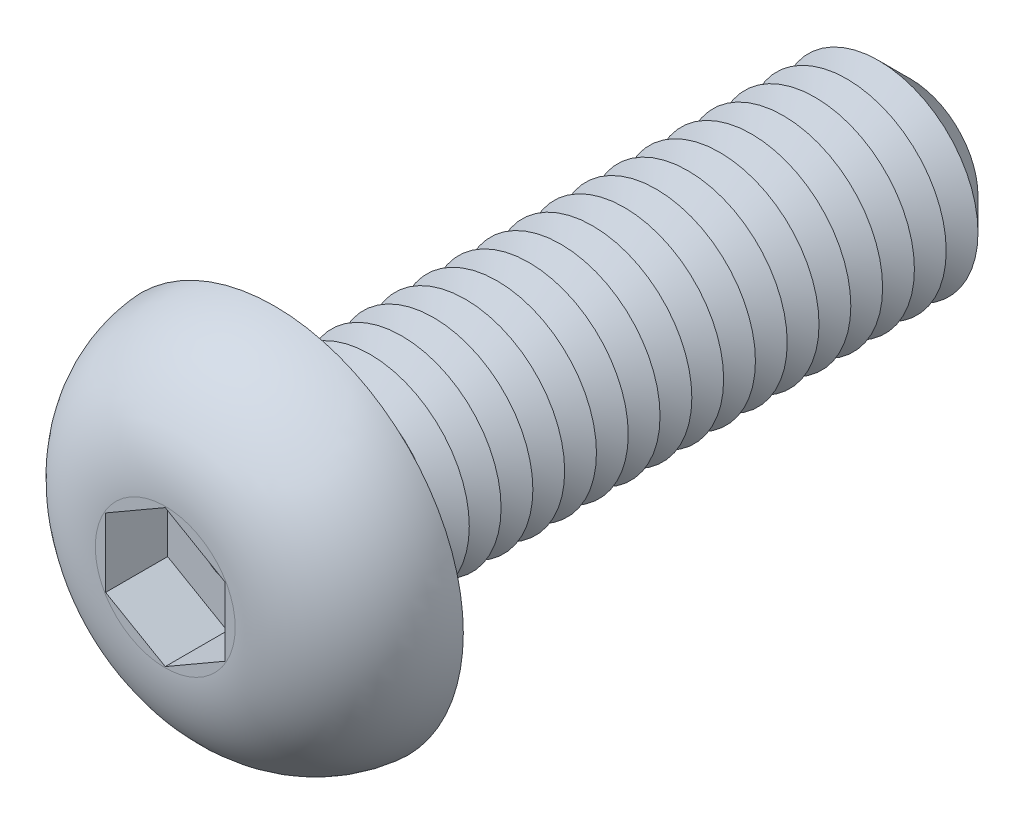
SolidWorks part; units mm, degrees
ref_plane "Front Plane" through (0, 0, 0) normal (0, 0, 1) x (1, 0, 0)
ref_plane "Top Plane" through (0, 0, 0) normal (0, 1, 0) x (1, 0, 0)
ref_plane "Right Plane" through (0, 0, 0) normal (1, 0, 0) x (0, 0, -1)
sketch "Sketch1" plane through (0, 0, 0) normal (1, 0, 0) x (0, 0, -1)
  line L0 (-47.9342, 0) -> (60.3146, 0) construction
sketch "Sketch2" plane through (0, 0, 0) normal (1, 0, 0) x (0, 0, -1)
  line L0 (0, 0) -> (-2.75, 0)
  line L1 (-47.9342, 0) -> (60.3146, 0) construction
  line L2 (-2.75, 0) -> (-2.75, 1.7604)
  line L3 (0, 4.75) -> (0, 0)
  arc A0 (-2.75, 1.7604) -> (0, 4.75) centre (0.25, 1.7604) cw
  dimension "D1" = 3
  dimension "D2" = 2.75
  dimension "D3" = 4.75
revolve "Revolve1" add sketch "Sketch2" angle 360 about L0
sketch "Sketch3" plane through (0, 0, 2.75) normal (0, 0, 1) x (1, 0, 0)
  line L1 (0, 1.7321) -> (-1.5, 0.866)
  line L2 (-1.5, 0.866) -> (-1.5, -0.866)
  line L3 (-1.5, -0.866) -> (0, -1.7321)
  line L4 (0, -1.7321) -> (1.5, -0.866)
  line L5 (1.5, -0.866) -> (1.5, 0.866)
  line L6 (1.5, 0.866) -> (0, 1.7321)
  circle A0 centre (0, 0) radius 1.5 construction
  dimension "D1" = 3
extrude "Cut-Extrude1" cut sketch "Sketch3" against normal blind 1.56
sketch "Sketch4" plane through (0, 0, 0) normal (0, 0, -1) x (-1, 0, 0)
  circle A0 centre (0, 0) radius 2.5
  dimension "D1" = 5
extrude "Boss-Extrude1" add sketch "Sketch4" along normal blind 16
chamfer "Chamfer1" distance 0.8 angle 45 1 edges at (-2.5, 0, -16)
sketch "Sketch5" plane through (0, 0, 0) normal (1, 0, 0) x (0, 0, -1)
  line L0 (0.8, 2.5) -> (1.6, 2.5)
  line L1 (15.2, 2.5) -> (0, 2.5) construction
  line L2 (1.6, 2.5) -> (1.2, 1.8072)
  line L3 (1.2, 1.8072) -> (0.8, 2.5)
  line L4 (0, -4.75) -> (0, 4.75) construction
  line L5 (15.2, 2.5) -> (0, 2.5) construction
  dimension "D1" = 0.8
  dimension "D2" = 0.8
revolve "Cut-Revolve1" cut sketch "Sketch5" angle 360 about L0
pattern_linear "LPattern1" count 18 spacing 0.8 along (0, 0, -1) of "Cut-Revolve1"
fillet "Fillet2" radius 0.4 1 edges at (2.5, 0, 0)
sketch "Sketch6" plane through (0, 0, 1.19) normal (0, 0, 1) x (1, 0, 0)
  circle A0 centre (0, 0) radius 0.65
  dimension "D1" = 1.3
extrude "Cut-Extrude2" cut sketch "Sketch6" against normal up to surface (17.19 mm away)
